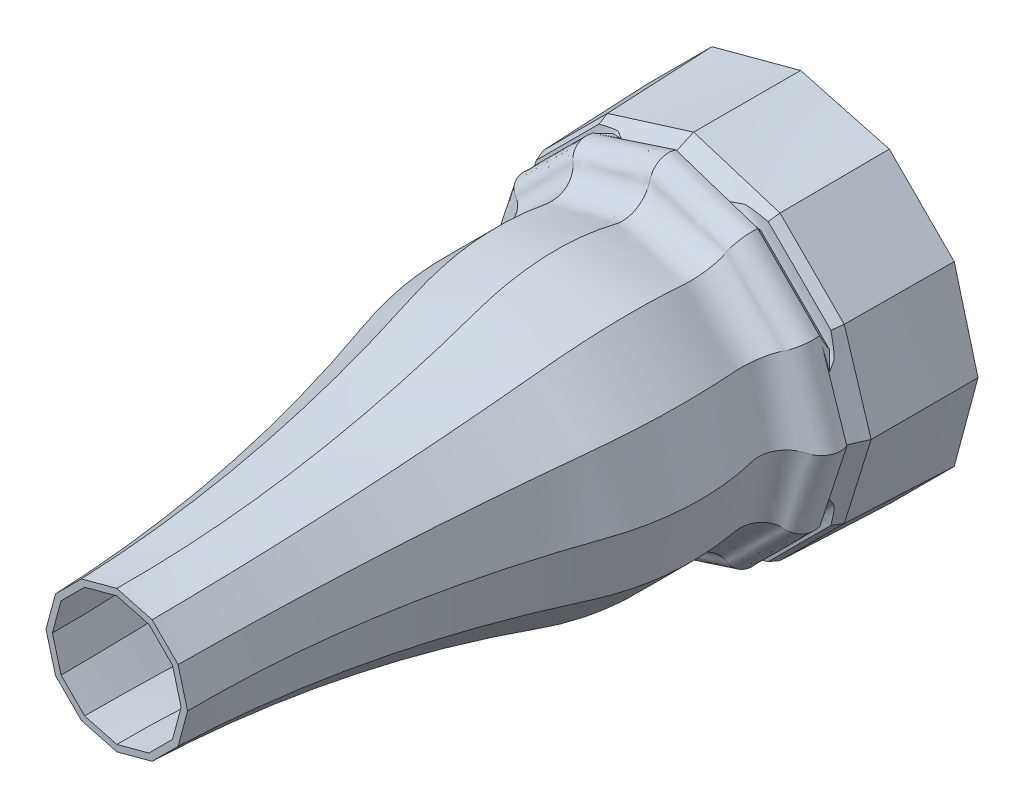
SolidWorks part; units mm, degrees
ref_plane "Plan de face" through (0, 0, 0) normal (0, 0, 1) x (1, 0, 0)
ref_plane "Plan de dessus" through (0, 0, 0) normal (0, 1, 0) x (1, 0, 0)
ref_plane "Plan de droite" through (0, 0, 0) normal (1, 0, 0) x (0, 0, -1)
sketch "Esquisse2" plane through (0, 0, 0) normal (0, 0, 1) x (1, 0, 0)
  line L1 (137.5, 238.157) -> (0, 275)
  line L2 (0, 275) -> (-137.5, 238.157)
  line L3 (-137.5, 238.157) -> (-238.157, 137.5)
  line L4 (-238.157, 137.5) -> (-275, 0)
  line L5 (-275, 0) -> (-238.157, -137.5)
  line L6 (-238.157, -137.5) -> (-137.5, -238.157)
  line L7 (-137.5, -238.157) -> (0, -275)
  line L8 (0, -275) -> (137.5, -238.157)
  line L9 (137.5, -238.157) -> (238.157, -137.5)
  line L10 (238.157, -137.5) -> (275, 0)
  line L11 (275, 0) -> (238.157, 137.5)
  line L12 (238.157, 137.5) -> (137.5, 238.157)
  circle A0 centre (0, 0) radius 275 construction
ref_plane "Plan2" through (0, 0, 1100) normal (0, 0, 1) x (1, 0, 0)
sketch "Esquisse4" plane through (0, 0, 1100) normal (0, 0, 1) x (1, 0, 0)
  line L1 (51.75, 89.6336) -> (0, 103.5)
  line L2 (0, 103.5) -> (-51.75, 89.6336)
  line L3 (-51.75, 89.6336) -> (-89.6336, 51.75)
  line L4 (-89.6336, 51.75) -> (-103.5, 0)
  line L5 (-103.5, 0) -> (-89.6336, -51.75)
  line L6 (-89.6336, -51.75) -> (-51.75, -89.6336)
  line L7 (-51.75, -89.6336) -> (0, -103.5)
  line L8 (0, -103.5) -> (51.75, -89.6336)
  line L9 (51.75, -89.6336) -> (89.6336, -51.75)
  line L10 (89.6336, -51.75) -> (103.5, 0)
  line L11 (103.5, 0) -> (89.6336, 51.75)
  line L12 (89.6336, 51.75) -> (51.75, 89.6336)
  circle A0 centre (0, 0) radius 103.5 construction
sketch "Esquisse7" plane through (0, 0, 0) normal (0, 1, 0) x (1, 0, 0)
  line L0 (0, 0) -> (0, -1100) construction
  line L1 (-275, 0) -> (-275, -170)
  line L2 (275, 0) -> (275, -170)
  line L3 (275, -170) -> (271, -179)
  line L4 (-275, -170) -> (-271, -179)
  arc A0 (200, -519.3601) -> (210.2279, -300) centre (-161.4118, -392.5905) ccw
  arc A1 (210.2279, -300) -> (250.3595, -233.2365) centre (263.6754, -286.6841) cw
  arc A2 (250.3595, -233.2365) -> (265.9657, -207.2738) centre (245.1812, -212.452) ccw
  arc A3 (-250.3595, -233.2365) -> (-265.9657, -207.2738) centre (-245.1812, -212.452) cw
  arc A4 (-210.2279, -300) -> (-250.3595, -233.2365) centre (-263.6754, -286.6841) ccw
  arc A5 (-200, -519.3601) -> (-210.2279, -300) centre (161.4118, -392.5905) cw
  spline S0 degree 3 poles (103.5, -1100) (101.861, -900.9896) (134.0276, -707.4429) (200, -519.3601) knots 0 0 0 0 1 1 1 1
  spline S1 degree 2 poles (265.9657, -207.2738) (221.8191, -183.9553) (271, -179) knots 0 0 0 1 1 1
  spline S2 degree 2 poles (-265.9657, -207.2738) (-221.8191, -183.9553) (-271, -179) knots 0 0 0 1 1 1
  spline S3 degree 3 poles (-103.5, -1100) (-101.861, -900.9896) (-134.0276, -707.4429) (-200, -519.3601) knots 0 0 0 0 1 1 1 1
  dimension "D6" = 383
  dimension "D1" = 170
  dimension "D2" = 4
  dimension "D3" = 9
  dimension "D4" = 124
  dimension "D5" = 200
  dimension "D7" = 800
sketch "Esquisse8" plane through (0, 0, 0) normal (1, 0, 0) x (0, -1, 0)
  line L0 (0, 0) -> (0, -1100) construction
  line L1 (-275, 0) -> (-275, -170)
  line L2 (275, 0) -> (275, -170)
  line L3 (275, -170) -> (271, -179)
  line L4 (-275, -170) -> (-271, -179)
  arc A0 (200, -519.3601) -> (210.2279, -300) centre (-161.4118, -392.5905) ccw
  arc A1 (210.2279, -300) -> (250.3595, -233.2365) centre (263.6754, -286.6841) cw
  arc A2 (250.3595, -233.2365) -> (265.9657, -207.2738) centre (245.1812, -212.452) ccw
  arc A3 (-250.3595, -233.2365) -> (-265.9657, -207.2738) centre (-245.1812, -212.452) cw
  arc A4 (-210.2279, -300) -> (-250.3595, -233.2365) centre (-263.6754, -286.6841) ccw
  arc A5 (-200, -519.3601) -> (-210.2279, -300) centre (161.4118, -392.5905) cw
  spline S0 degree 3 poles (103.5, -1100) (101.861, -900.9896) (134.0276, -707.4429) (200, -519.3601) knots 0 0 0 0 1 1 1 1
  spline S1 degree 2 poles (265.9657, -207.2738) (221.8191, -183.9553) (271, -179) knots 0 0 0 1 1 1
  spline S2 degree 2 poles (-265.9657, -207.2738) (-221.8191, -183.9553) (-271, -179) knots 0 0 0 1 1 1
  spline S3 degree 3 poles (-103.5, -1100) (-101.861, -900.9896) (-134.0276, -707.4429) (-200, -519.3601) knots 0 0 0 0 1 1 1 1
loft "Lissage-Mince1" add profiles "Esquisse4", "Esquisse2" parameters "D1"=10
